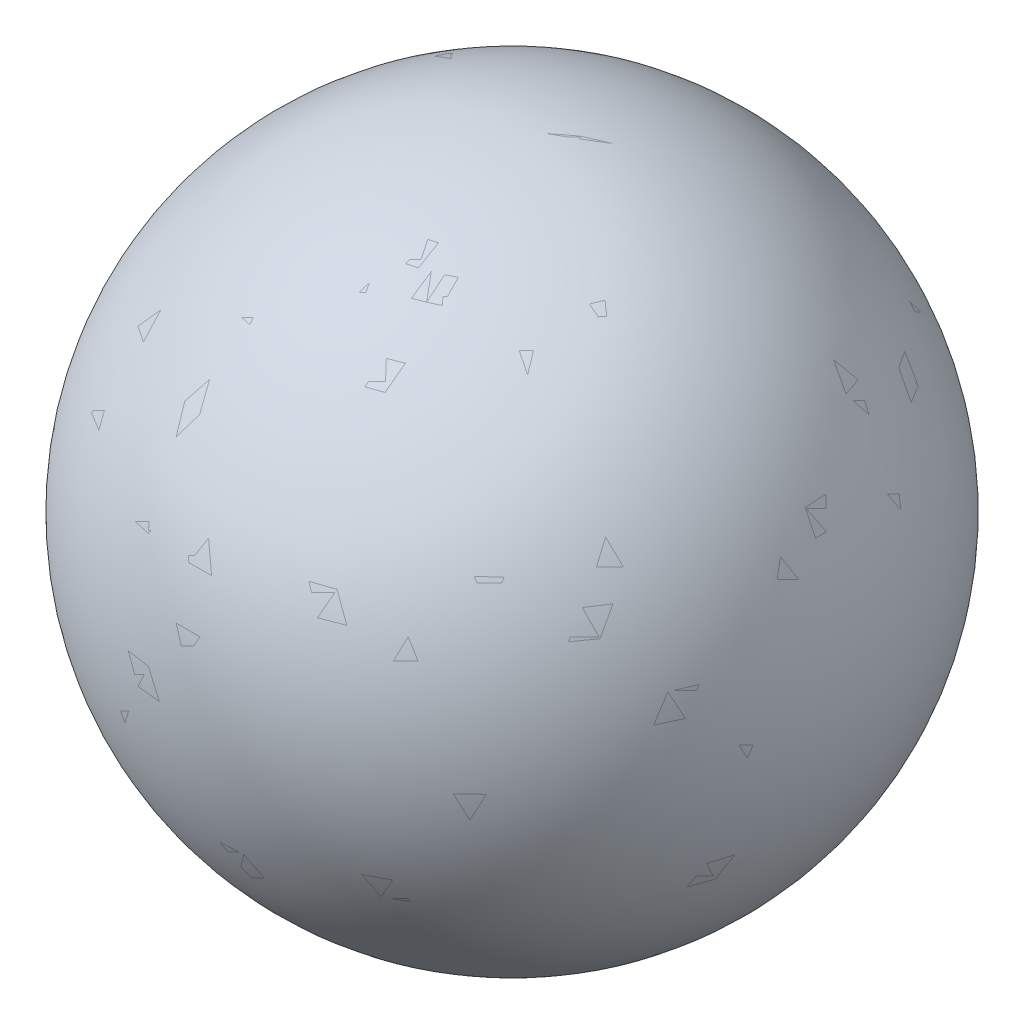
SolidWorks part; units mm, degrees
ref_plane "Ebene vorne" through (0, 0, 0) normal (0, 0, 1) x (1, 0, 0)
ref_plane "Ebene oben" through (0, 0, 0) normal (0, 1, 0) x (1, 0, 0)
ref_plane "Ebene rechts" through (0, 0, 0) normal (1, 0, 0) x (0, 0, -1)
sketch "Skizze2" plane through (0, 0, 0) normal (0, 0, 1) x (1, 0, 0)
  line L0 (0, 0) -> (0, -50000) construction
  circle A0 centre (0, 0) radius 35
  dimension "D1" = 70
revolve "Rotation3" add sketch "Skizze2" angle 360 about L0
surface "Oberfläche-Offset1" parameters "D1"=0
ref_plane "Ebene1" through (0, -24.75, 0) normal (0, 1, 0) x (1, 0, 0)
sketch "Rollkreis" plane through (0, -24.75, 0) normal (0, 1, 0) x (1, 0, 0)
  circle A0 centre (0, 0) radius 24.7475
  point P3 (-24.7475, 0)
